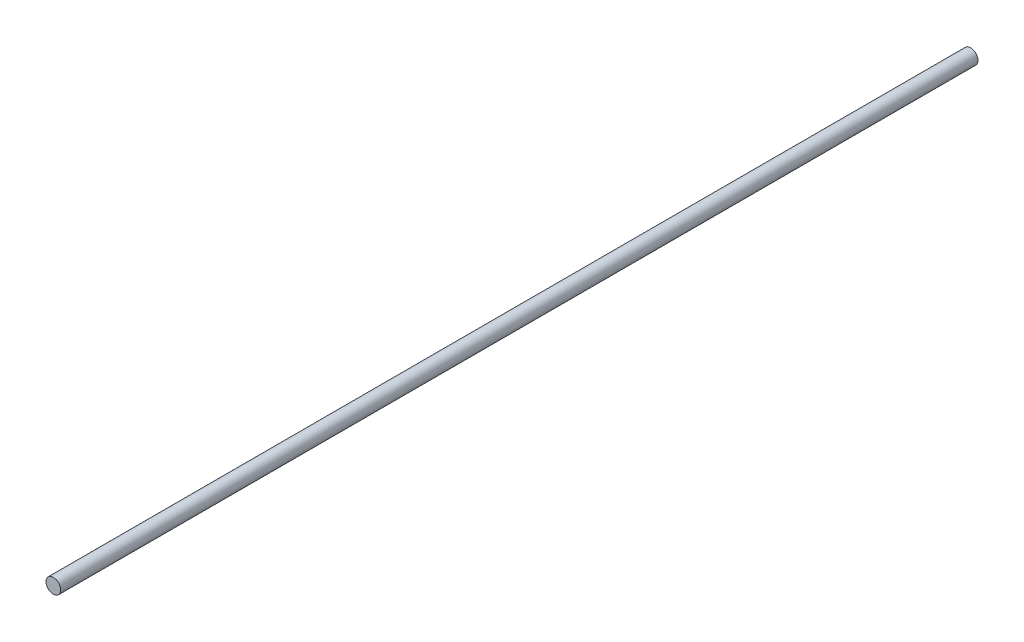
SolidWorks part; units mm, degrees
ref_plane "Front Plane" through (0, 0, 0) normal (0, 0, 1) x (1, 0, 0)
ref_plane "Top Plane" through (0, 0, 0) normal (0, 1, 0) x (1, 0, 0)
ref_plane "Right Plane" through (0, 0, 0) normal (1, 0, 0) x (0, 0, -1)
sketch "Sketch1" plane through (0, 0, 0) normal (0, 0, 1) x (1, 0, 0)
  circle A0 centre (0, 0) radius 30
  dimension "D1" = 60
extrude "Boss-Extrude1" add sketch "Sketch1" against normal blind 3750
